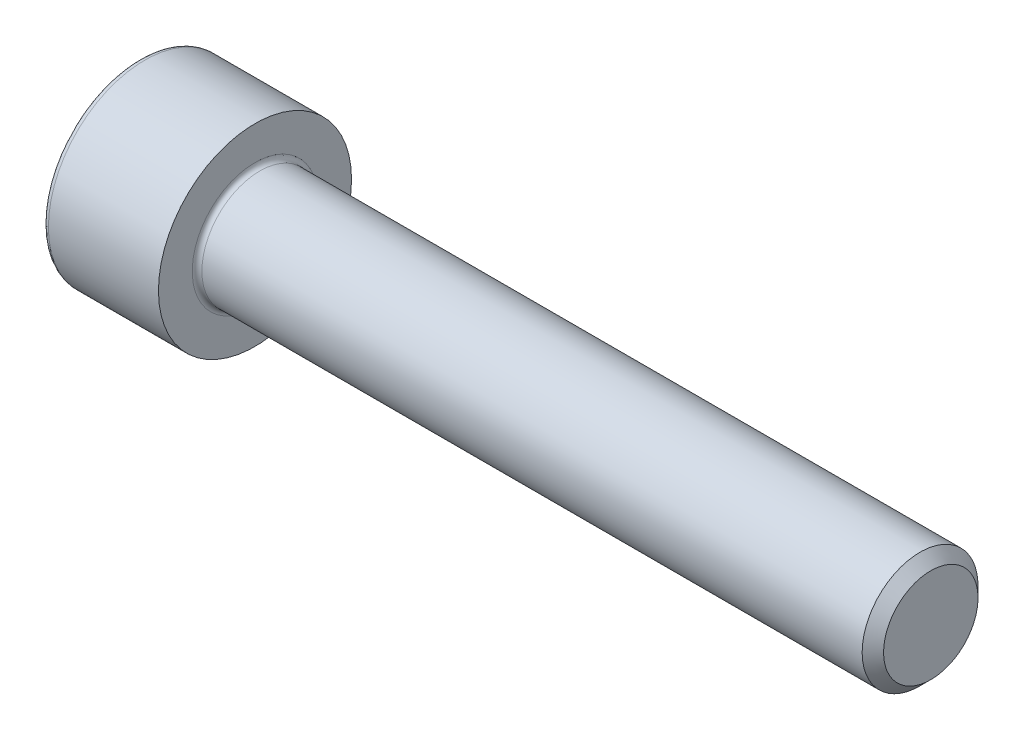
SolidWorks part; units mm, degrees
ref_plane "Plane1" through (0, 0, 0) normal (0, 0, 1) x (1, 0, 0)
ref_plane "Plane2" through (0, 0, 0) normal (0, 1, 0) x (1, 0, 0)
ref_plane "Plane3" through (0, 0, 0) normal (1, 0, 0) x (0, 0, -1)
revolve "Base-Revolve" add sketch "BodySke"
sketch "BodySke" plane through (0, 0, 0) normal (0, 0, 1) x (1, 0, 0)
  line L0 (0, 0) -> (0, 5)
  line L1 (0, 5) -> (6, 5)
  line L2 (6, 5) -> (6, 3)
  line L3 (6, 3) -> (40.4455, 3)
  line L4 (41, 2.4455) -> (41, 0)
  line L5 (41, 0) -> (0, 0)
  line L6 (-31.75, 0) -> (127, 0) construction
  line L8 (41, 2.4455) -> (40.4455, 3)
  line L10 (41, -2.4455) -> (40.4455, -3) construction
  line L11 (7, 9.525) -> (7, 3.175) construction
  line L12 (17, 9.525) -> (17, 3.175) construction
  line L13 (-19, 9.525) -> (-19, 3.175) construction
  dimension "Diameter" = 6
  dimension "Head_ht" = 6
  dimension "Length" = 35
  dimension "Body_ch_ang" = 45
  dimension "Head_dia" = 10
  dimension "Minor_dia" = 4.891
  dimension "Advance" = 1
  dimension "Thread_nom" = 24
  dimension "Thread_length" = 60
fillet "Fillet1" radius 0.25 1 edges at (6, 0, 3)
fillet "Fillet2" radius 0.3 1 edges at (0, 0, 5)
sketch "Sketch2" plane through (0, 0, 0) normal (0, 0, 1) x (1, 0, 0)
  line L0 (0, 2.542) -> (3, 2.542)
  line L1 (3, 2.542) -> (4.4676, 0)
  line L2 (-31.75, 0) -> (127, 0) construction
  line L3 (4.4676, 0) -> (0, 0)
  line L4 (0, 0) -> (0, 2.542)
  line L6 (0, 0) -> (47.625, 0) construction
  dimension "D1" = 2.542
  dimension "D2" = 60
  dimension "Depth" = 3
revolve "Hex-PreBroach" cut sketch "Sketch2" angle 360 about L6
sketch "Sketch3" plane through (0, 0, 0) normal (-1, 0, 0) x (0, 0.5, 0.866)
  line L0 (1.4676, 2.542) -> (-1.4676, 2.542)
  line L1 (-1.4676, 2.542) -> (-2.9352, 0)
  line L2 (1.4676, 2.542) -> (2.9352, 0)
  line L3 (1.4676, -2.542) -> (2.9352, 0)
  line L4 (1.4676, -2.542) -> (-1.4676, -2.542)
  line L5 (-1.4676, -2.542) -> (-2.9352, 0)
  dimension "D1" = 2.542
  dimension "D2" = 2.542
  dimension "Hex_size" = 5.084
extrude "Hex" cut sketch "Sketch3" against normal blind 3
sketch "ThdSchSke" plane through (0, 0, 0) normal (0, 0, 1) x (1, 0, 0)
  line L0 (17, -2.4455) -> (16.6117, -3)
  line L1 (17, -2.4455) -> (17.3883, -3)
  line L2 (17.3883, -3) -> (17.3883, -3.75)
  line L3 (-3.175, 0) -> (5.1513, 0) construction
  line L4 (0, 4.7) -> (0, -4.7) construction
  line L5 (17.3883, -3.75) -> (16.6117, -3.75)
  line L6 (16.6117, -3.75) -> (16.6117, -3)
  dimension "Thread_minor" = 4.891
  dimension "Diameter" = 6
  dimension "Start" = 17
  dimension "SideAngle" = 55
  dimension "VeeAngle" = 70
  dimension "Overcut" = 7.5
revolve "ThreadSchematic" [suppressed] cut sketch "ThdSchSke" angle 360 about L3
pattern_linear "ThdSchPat" [suppressed]
equation "\"D2@Sketch3\" = \"Hex_size@Sketch3\" / 2"
equation "\"D1@Sketch3\" = \"Hex_size@Sketch3\" / 2"
equation "\"D1@Sketch2\" = \"Hex_size@Sketch3\" / 2"
equation "\"Thread_minor@ThreadCosmetic\"  =  \"Minor_dia@BodySke\""
equation "\"Depth@Sketch2\" =  \"Key_eng@Hex\""
equation "\"Thread_length@ThreadCosmetic\" = ((sgn( (\"Length@BodySke\" - \"Advance@BodySke\" * 3.0) - \"Thread_nom@BodySke\" )-1)*( (\"Length@BodySke\" - \"Advance@BodySke\" * 3.0) - \"Thread_nom@BodySke\" ))/-2+ \"Thread_no"
equation "\"Thread_minor@ThdSchSke\" = \"Minor_dia@BodySke\""
equation "\"Diameter@ThdSchSke\" = \"Diameter@BodySke\""
equation "\"Overcut@ThdSchSke\" = \"Diameter@BodySke\" * 1.25"
equation "\"Start@ThdSchSke\" = \"Head_ht@BodySke\" + \"Length@BodySke\" - \"Thread_length@ThreadCosmetic\"  '---Non-countersunk---"
equation "\"Num_threads@ThdSchPat\" = int( \"Thread_length@ThreadCosmetic\" / \"Advance@BodySke\" + 0.999 )  + 1"
equation "\"Advance@ThdSchPat\" = \"Thread_length@ThreadCosmetic\" /  (\"Num_threads@ThdSchPat\" - 1) 'relax it"
equation "\"Num_threads@ThdSchPat\" = \"Num_threads@ThdSchPat\" - sgn( \"Num_threads@ThdSchPat\" - 1) '---chamfered tips only---"
